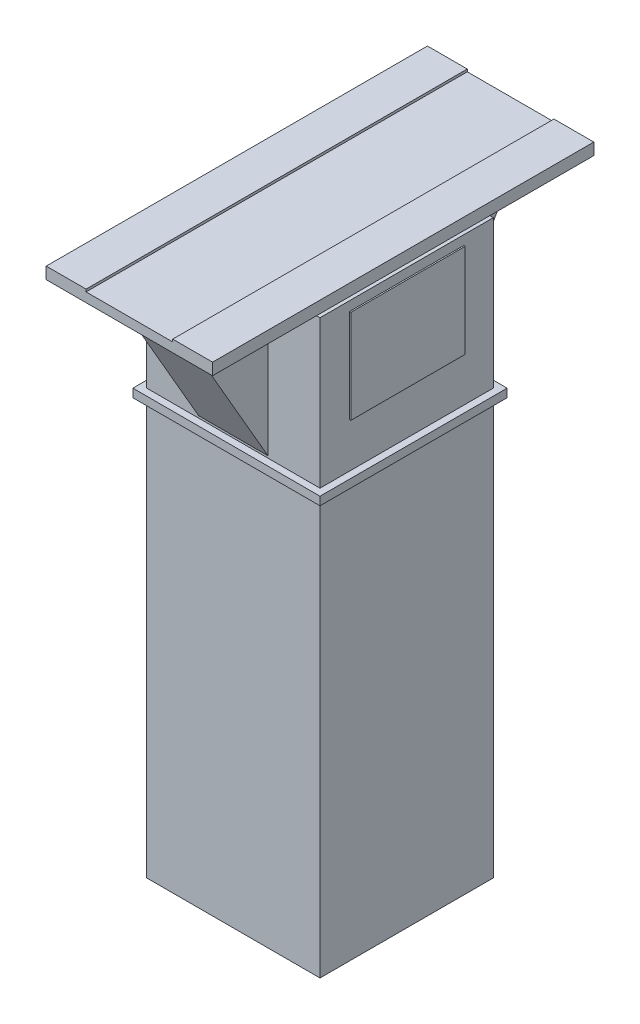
SolidWorks part; units mm, degrees
ref_plane "Ebene vorne" through (0, 0, 0) normal (0, 0, 1) x (1, 0, 0)
ref_plane "Ebene oben" through (0, 0, 0) normal (0, 1, 0) x (1, 0, 0)
ref_plane "Ebene rechts" through (0, 0, 0) normal (1, 0, 0) x (0, 0, -1)
sketch "Skizze1" plane through (0, 0, 0) normal (0, 1, 0) x (1, 0, 0)
  line L1 (125, -125) -> (-125, -125)
  line L2 (125, -125) -> (125, 125)
  line L3 (125, 125) -> (-125, 125)
  line L4 (-125, -125) -> (-125, 125)
  line L5 (125, -125) -> (-125, 125) construction
  line L6 (125, 125) -> (-125, -125) construction
  point P0 (0, 0)
  dimension "D1" = 250
extrude "Aufsatz-Linear austragen1" add sketch "Skizze1" along normal blind 600
sketch "Skizze4" plane through (0, 600, 0) normal (0, 1, 0) x (1, 0, 0)
  line L0 (-135, 135) -> (135, -135) construction
  line L8 (135, 135) -> (-135, 135)
  line L9 (-135, 135) -> (-135, -135)
  line L10 (-135, -135) -> (135, -135)
  line L11 (135, -135) -> (135, 135)
  dimension "D1" = 270
extrude "Aufsatz-Linear austragen4" add sketch "Skizze4" along normal blind 12 separate body
sketch "Skizze5" plane through (0, 612, 0) normal (0, 1, 0) x (1, 0, 0)
  line L0 (-125, -125) -> (125, -125) construction
  line L1 (-125, 125) -> (125, 125)
  line L2 (-125, 125) -> (-125, -125)
  line L3 (-125, -125) -> (125, -125)
  line L4 (125, 125) -> (125, -125)
  line L5 (125, -125) -> (125, 125) construction
  line L6 (125, 125) -> (-125, 125) construction
extrude "Aufsatz-Linear austragen5" add sketch "Skizze5" along normal blind 213 separate body
sketch "Skizze6" plane through (0, 0, 0) normal (0, 0, 1) x (1, 0, 0)
  line L0 (-120, 825) -> (120, 825)
  line L1 (120, 825) -> (120, 842)
  line L2 (120, 842) -> (62.5, 842)
  line L3 (62.5, 842) -> (62.5, 838.5)
  line L4 (62.5, 838.5) -> (-62.5, 838.5)
  line L5 (-62.5, 838.5) -> (-62.5, 842)
  line L6 (-62.5, 842) -> (-120, 842)
  line L7 (-120, 842) -> (-120, 825)
  line L8 (-125, 825) -> (125, 825) construction
  point P2 (0, 825)
  dimension "D1" = 240
  dimension "D2" = 125
  dimension "D3" = 3.5
  dimension "D4" = 17
extrude "Aufsatz-Linear austragen6" add sketch "Skizze6" along normal mid plane 550 separate body
sketch "Skizze7" plane through (0, 0, 0) normal (1, 0, 0) x (0, 0, -1)
  line L0 (-246.2436, 825) -> (-125, 615)
  line L1 (-275, 825) -> (275, 825) construction
  line L2 (-125, 825) -> (-125, 612) construction
  line L3 (-125, 615) -> (-125, 825)
  line L4 (-125, 825) -> (-246.2436, 825)
  line L5 (0, 1915.2452) -> (0, -188.0205) construction
  line L6 (125, 825) -> (246.2436, 825)
  line L7 (125, 615) -> (125, 825)
  line L8 (246.2436, 825) -> (125, 615)
  line L9 (-234.6966, 825) -> (-125, 635) construction
  line L10 (-125, 600) -> (-125, 0) construction
  dimension "D1" = 10
  dimension "D2" = 210
  dimension "D3" = 30
extrude "Aufsatz-Linear austragen7" add sketch "Skizze7" along normal mid plane 100 separate body
sketch "Skizze8" plane through (0, 0, 0) normal (-1, 0, 0) x (0, 0, 1)
  line L0 (-125, 825) -> (125, 825) construction
  line L1 (-82.5, 811.5) -> (82.5, 811.5)
  line L2 (-82.5, 811.5) -> (-82.5, 676.5)
  line L3 (-82.5, 676.5) -> (82.5, 676.5)
  line L4 (82.5, 811.5) -> (82.5, 676.5)
  line L5 (0, 676.5) -> (0, 0) construction
  dimension "D1" = 165
  dimension "D2" = 135
  dimension "D3" = 13.5
extrude "Aufsatz-Linear austragen8" add sketch "Skizze8" along normal mid plane 254
sketch "Skizze9" plane through (0, 825, 0) normal (0, -1, 0) x (1, 0, 0)
  line L0 (-75, 250) -> (75, 250) construction
  line L1 (0, 0) -> (0, 250) construction
  line L3 (-75, 255.7735) -> (-80, 252.8868)
  line L4 (-80, 252.8868) -> (-80, 247.1132)
  line L5 (-80, 247.1132) -> (-75, 244.2265)
  line L6 (-75, 244.2265) -> (-70, 247.1132)
  line L7 (-70, 247.1132) -> (-70, 252.8868)
  line L8 (-70, 252.8868) -> (-75, 255.7735)
  line L9 (75, 255.7735) -> (70, 252.8868)
  line L10 (70, 252.8868) -> (70, 247.1132)
  line L11 (70, 247.1132) -> (75, 244.2265)
  line L12 (75, 244.2265) -> (80, 247.1132)
  line L13 (80, 247.1132) -> (80, 252.8868)
  line L14 (80, 252.8868) -> (75, 255.7735)
  circle A0 centre (-75, 250) radius 9
  circle A1 centre (75, 250) radius 9
  circle A2 centre (-75, 250) radius 5 construction
  circle A3 centre (75, 250) radius 5 construction
  dimension "D1" = 18
  dimension "D2" = 150
  dimension "D3" = 250
  dimension "D4" = 10
extrude "Aufsatz-Linear austragen9" add sketch "Skizze9" along normal blind 12
pattern_linear "Lineares Muster1" count 6 spacing 100 along (0, 0, -1) of "Aufsatz-Linear austragen9"
